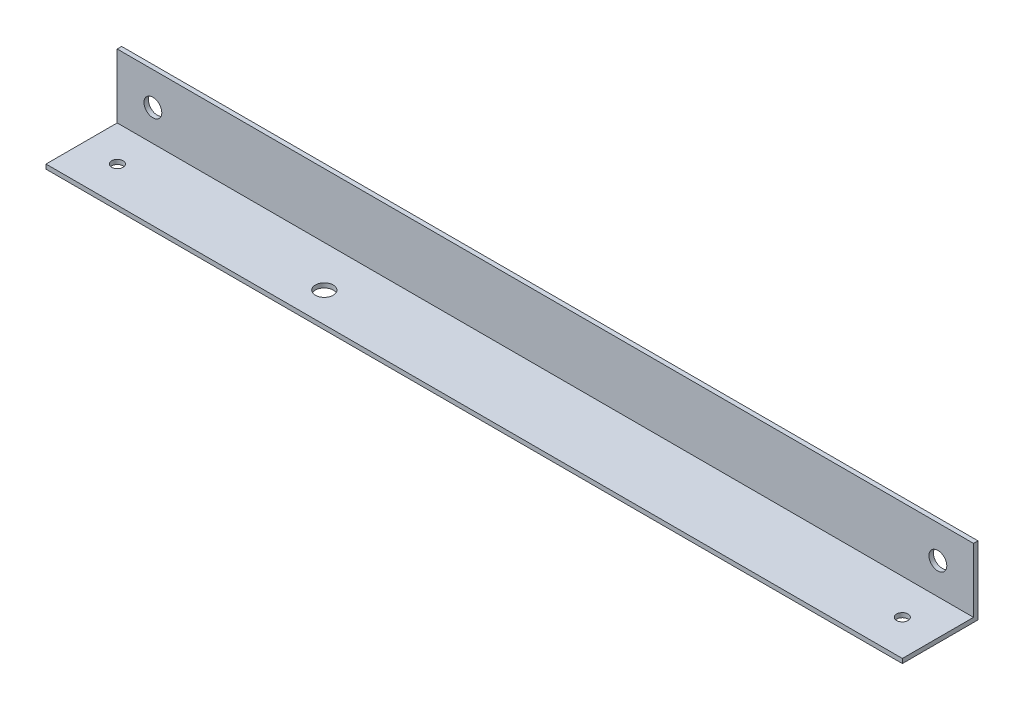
SolidWorks part; units mm, degrees
ref_plane "Front" through (0, 0, 0) normal (0, 0, 1) x (1, 0, 0)
ref_plane "Top" through (0, 0, 0) normal (0, 1, 0) x (1, 0, 0)
ref_plane "Right" through (0, 0, 0) normal (1, 0, 0) x (0, 0, -1)
sketch "Sketch1" plane through (0, 0, 0) normal (0, 0, 1) x (1, 0, 0)
  line L1 (-209.8261, 67.8385) -> (94.9739, 67.8385)
  line L2 (-209.8261, 67.8385) -> (-209.8261, 43.4545)
  line L3 (-209.8261, 43.4545) -> (94.9739, 43.4545)
  line L4 (94.9739, 67.8385) -> (94.9739, 43.4545)
  dimension "D1" = 304.8
  dimension "D2" = 24.384
extrude "Boss-Extrude1" add sketch "Sketch1" along normal blind 26.924
sketch "Sketch2" plane through (0, 67.8385, 0) normal (0, 1, 0) x (1, 0, 0)
  line L0 (-209.8261, -26.924) -> (-209.8261, 0) construction
  line L1 (-209.8261, -1.5875) -> (94.9739, -1.5875)
  line L2 (-209.8261, -1.5875) -> (-209.8261, -26.924)
  line L3 (-209.8261, -26.924) -> (94.9739, -26.924)
  line L4 (94.9739, -1.5875) -> (94.9739, -26.924)
  line L5 (94.9739, 0) -> (-209.8261, 0) construction
  dimension "D1" = 1.5875
extrude "Cut-Extrude1" cut sketch "Sketch2" against normal blind 12.7
sketch "Sketch3" plane through (0, 0, 26.924) normal (0, 0, 1) x (1, 0, 0)
  line L0 (94.9739, 43.4545) -> (94.9739, 55.1385) construction
  line L1 (-209.8261, 55.1385) -> (94.9739, 55.1385)
  line L2 (-209.8261, 55.1385) -> (-209.8261, 45.042)
  line L3 (-209.8261, 45.042) -> (94.9739, 45.042)
  line L4 (94.9739, 55.1385) -> (94.9739, 45.042)
  line L5 (-209.8261, 43.4545) -> (94.9739, 43.4545) construction
  dimension "D1" = 1.5875
extrude "Cut-Extrude3" cut sketch "Sketch3" against normal up to surface (25.3365 mm away)
sketch "Sketch4" plane through (0, 0, 0) normal (0, 0, -1) x (-1, 0, 0)
  line L0 (-94.9739, 43.4545) -> (-94.9739, 67.8385) construction
  line L1 (209.8261, 43.4545) -> (-94.9739, 43.4545) construction
  line L2 (57.4261, 28.0211) -> (57.4261, 119.205) construction
  circle A0 centre (-82.2739, 56.1545) radius 3.175
  circle A1 centre (197.1261, 56.1545) radius 3.175
  dimension "D3" = 6.35
  dimension "D1" = 12.7
  dimension "D2" = 12.7
extrude "Cut-Extrude4" cut sketch "Sketch4" against normal blind 2.54
sketch "Sketch5" plane through (0, 43.4545, 0) normal (0, -1, 0) x (1, 0, 0)
  line L0 (-57.4261, 38.6497) -> (-57.4261, -24.6724) construction
  line L1 (-209.8261, 26.924) -> (-209.8261, 0) construction
  line L2 (-209.8261, 26.924) -> (94.9739, 26.924) construction
  circle A0 centre (-197.1261, 14.224) radius 2.032
  circle A1 centre (82.2739, 14.224) radius 2.032
  dimension "D1" = 4.064
  dimension "D2" = 12.7
  dimension "D3" = 12.7
extrude "Cut-Extrude5" cut sketch "Sketch5" against normal blind 2.54
sketch "Sketch6" plane through (0, 43.4545, 0) normal (0, -1, 0) x (1, 0, 0)
  line L0 (94.9739, 26.924) -> (94.9739, 0) construction
  line L1 (-209.8261, 26.924) -> (94.9739, 26.924) construction
  circle A0 centre (-121.4333, 16.256) radius 3.175
  point P3 (94.9739, 13.462)
  dimension "D1" = 6.35
  dimension "D2" = 10.668
extrude "Cut-Extrude6" cut sketch "Sketch6" against normal blind 2.54
equation "\".5n\"=1"
